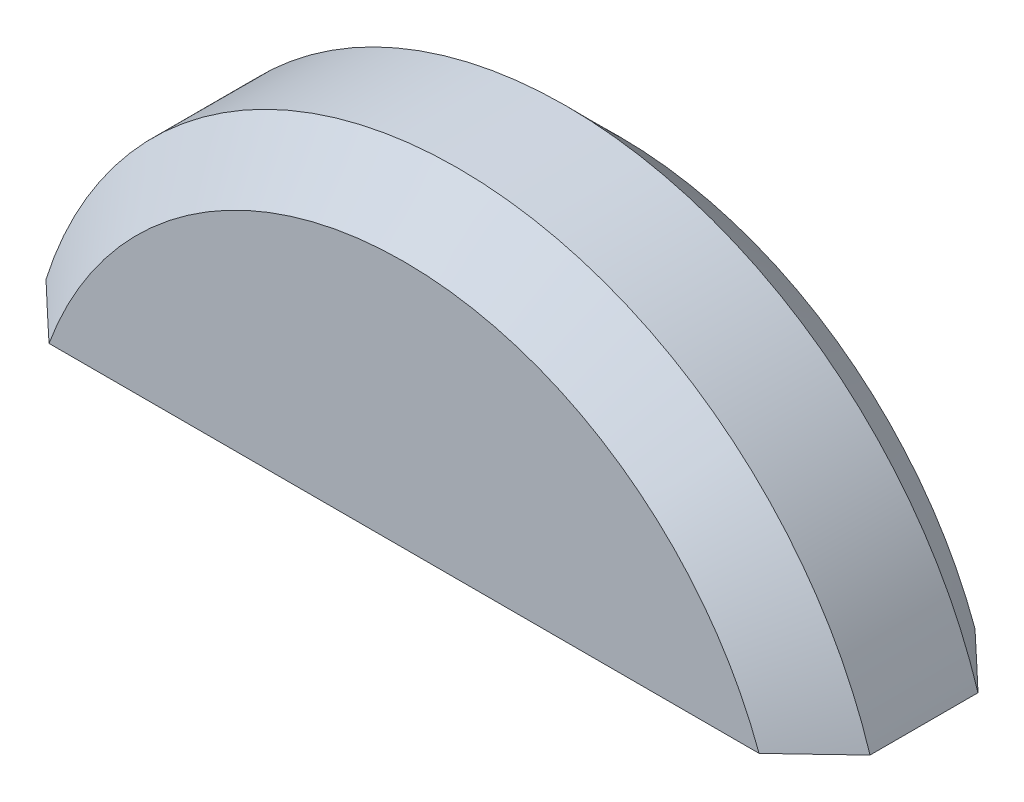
SolidWorks part; units mm, degrees
ref_plane "front" through (0, 0, 0) normal (0, 0, 1) x (1, 0, 0)
ref_plane "top" through (0, 0, 0) normal (0, 1, 0) x (1, 0, 0)
ref_plane "right" through (0, 0, 0) normal (1, 0, 0) x (0, 0, -1)
other "Configuration Table"
sketch "body" plane through (0, 0, 0) normal (0, 0, 1) x (1, 0, 0)
  line L0 (-1.9079, 0.6) -> (1.9079, 0.6)
  arc A0 (-1.9079, 0.6) -> (1.9079, 0.6) centre (0, 0) cw
  dimension "Diameter" = 4
  dimension "Height" = 1.4
extrude "Extrude1" add sketch "body" along normal blind 1
chamfer "Chamfer1" distance 0.25 2 edges at (0, 2, 1) (0, 2, 0)
